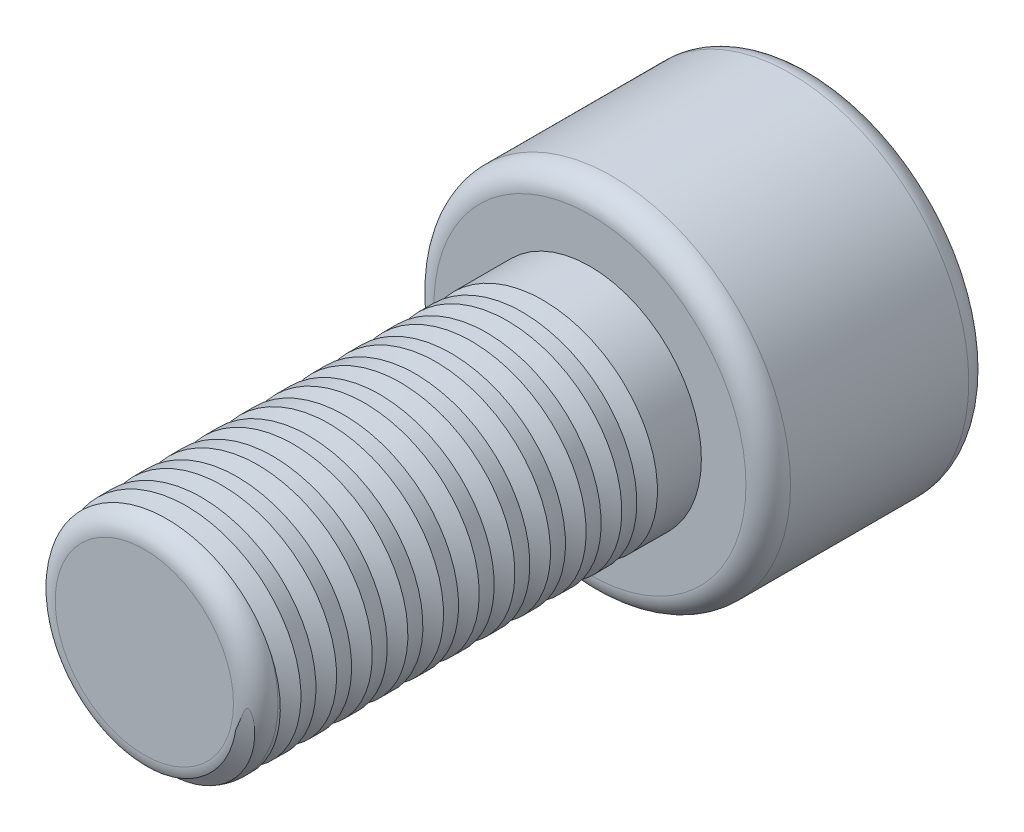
SolidWorks part; units mm, degrees
ref_plane "前视基准面" through (0, 0, 0) normal (0, 0, 1) x (1, 0, 0)
ref_plane "上视基准面" through (0, 0, 0) normal (0, 1, 0) x (1, 0, 0)
ref_plane "右视基准面" through (0, 0, 0) normal (1, 0, 0) x (0, 0, -1)
sketch "草图1" plane through (0, 0, 0) normal (0, 0, 1) x (1, 0, 0)
  circle A0 centre (0, 0) radius 4
extrude "凸台-拉伸1" add sketch "草图1" along normal blind 5
sketch "草图2" plane through (0, 0, 5) normal (0, 0, 1) x (1, 0, 0)
  circle A0 centre (0, 0) radius 2.5
extrude "凸台-拉伸2" add sketch "草图2" along normal blind 10
fillet "圆角1" radius 0.5 1 edges at (2.5, 0, 15)
sketch "草图3" plane through (0, 0, 15) normal (0, 0, 1) x (1, 0, 0)
  circle A0 centre (0, 0) radius 2.1
curve "螺旋线/涡状线1"
sketch "草图5" plane through (0, 0, 0) normal (0, 1, 0) x (1, 0, 0)
  line L0 (2.0987, -14.8045) -> (2.0987, -15.3624) construction
  line L1 (2.0987, -15.0204) -> (3.1284, -15.615)
  line L2 (3.1284, -15.615) -> (3.1284, -14.4259)
  line L3 (3.1284, -14.4259) -> (2.0987, -15.0204)
  circle A0 centre (2.7851, -15.0204) radius 0.3432 construction
  spline S0 degree 3 number of poles 193 (0, -15) -> (-1.4849, -5.5) construction
sweep "切除-扫描2" cut profiles "草图5" path "螺旋线/涡状线1"
sketch "草图6" plane through (0, 0, 0) normal (0, 0, -1) x (-1, 0, 0)
  line L1 (1.9063, -1.3035) -> (2.0821, 0.9992)
  line L2 (2.0821, 0.9992) -> (0.1757, 2.3027)
  line L3 (0.1757, 2.3027) -> (-1.9063, 1.3035)
  line L4 (-1.9063, 1.3035) -> (-2.0821, -0.9992)
  line L5 (-2.0821, -0.9992) -> (-0.1757, -2.3027)
  line L6 (-0.1757, -2.3027) -> (1.9063, -1.3035)
  circle A0 centre (0, 0) radius 2 construction
  dimension "D1" = 4
extrude "切除-拉伸1" cut sketch "草图6" against normal blind 3
fillet "圆角2" radius 0.5 2 edges at (4, 0, 5) (4, 0, 0)
